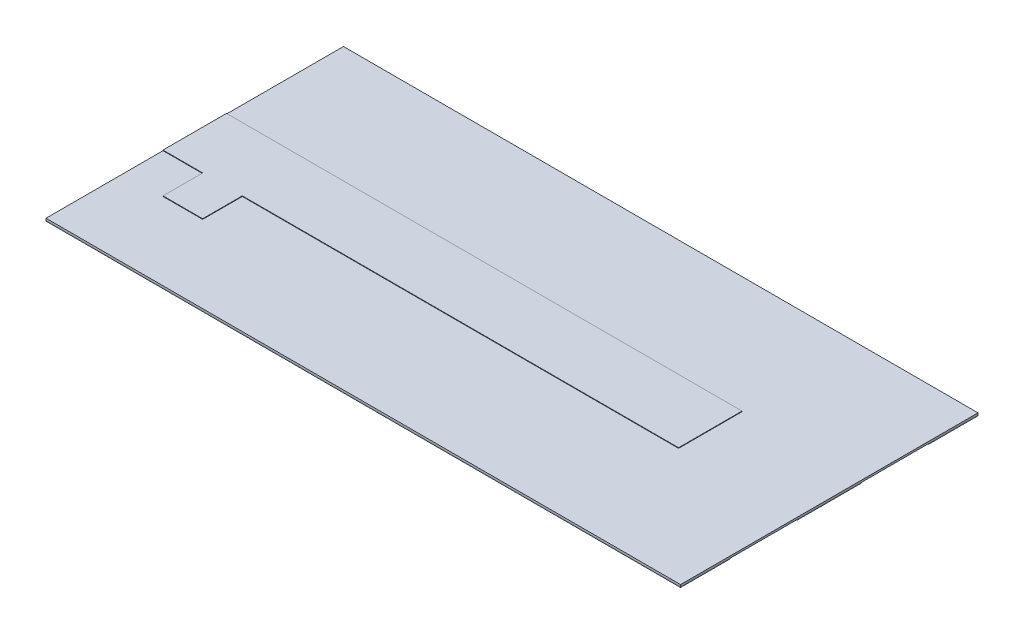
SolidWorks part; units mm, degrees
ref_plane "Front Plane" through (0, 0, 0) normal (0, 0, 1) x (1, 0, 0)
ref_plane "Top Plane" through (0, 0, 0) normal (0, 1, 0) x (1, 0, 0)
ref_plane "Right Plane" through (0, 0, 0) normal (1, 0, 0) x (0, 0, -1)
sketch "Sketch1" plane through (0, 0, 0) normal (0, 1, 0) x (1, 0, 0)
  line L1 (-20.32, 9.525) -> (20.32, 9.525)
  line L2 (-20.32, 9.525) -> (-20.32, -9.525)
  line L3 (-20.32, -9.525) -> (20.32, -9.525)
  line L4 (20.32, 9.525) -> (20.32, -9.525)
  line L5 (-20.32, 9.525) -> (20.32, -9.525) construction
  line L6 (-20.32, -9.525) -> (20.32, 9.525) construction
  point P0 (0, 0)
extrude "Boss-Extrude1" add sketch "Sketch1" along normal blind 0.127
sketch "Sketch3" plane through (0, 0.127, 0) normal (0, 1, 0) x (1, 0, 0)
  line L0 (-20.32, 0) -> (-20.32, 2.032)
  line L1 (-20.32, 9.525) -> (-20.32, -9.525) construction
  line L2 (-20.32, 2.032) -> (12.7, 2.032)
  line L3 (12.7, 2.032) -> (12.7, -2.032)
  line L4 (12.7, -2.032) -> (-20.32, -2.032)
  line L5 (-20.32, -2.032) -> (-20.32, 0)
extrude "Boss-Extrude2" add sketch "Sketch3" along normal blind 0.0356 separate body
sketch "Sketch4" plane through (0, 0, 0) normal (0, -1, 0) x (1, 0, 0)
  line L1 (20.32, -2.032) -> (-2.921, -2.032)
  line L12 (20.32, 9.525) -> (20.32, -9.525) construction
  line L13 (-2.921, -2.032) -> (-2.921, 2.032)
  line L14 (-20.32, 2.032) -> (12.7, 2.032) construction
  line L15 (-2.921, 2.032) -> (20.32, 2.032)
  line L16 (20.32, 2.032) -> (20.32, -2.032)
extrude "Boss-Extrude3" add sketch "Sketch4" along normal blind 0.0356 separate body
sketch "Sketch8" plane through (0, 0, 0) normal (0, -1, 0) x (1, 0, 0)
  line L0 (20.32, 9.525) -> (-20.32, 9.525)
  line L1 (-20.32, 9.525) -> (-20.32, 6.35)
  line L2 (-20.32, -9.525) -> (-20.32, 9.525) construction
  line L3 (-20.32, 6.35) -> (20.32, 6.35)
  line L4 (20.32, 9.525) -> (20.32, -9.525) construction
  line L5 (20.32, 6.35) -> (20.32, 9.525)
  line L6 (-20.32, -9.525) -> (-20.32, -6.35)
  line L7 (-20.32, -6.35) -> (20.32, -6.35)
  line L8 (20.32, -6.35) -> (20.32, -9.525)
  line L9 (20.32, -9.525) -> (-20.32, -9.525)
extrude "Boss-Extrude5" add sketch "Sketch8" along normal blind 0.0356 separate body
sketch "Sketch9" plane through (0, 0.127, 0) normal (0, 1, 0) x (1, 0, 0)
  line L0 (-20.32, -2.032) -> (-17.78, -2.032) construction
  line L1 (-17.78, -2.032) -> (-17.78, -4.572)
  line L2 (-17.78, -4.572) -> (-15.24, -4.572)
  line L3 (-15.24, -4.572) -> (-15.24, -2.032)
  line L4 (-20.32, -2.032) -> (12.7, -2.032) construction
  line L5 (-15.24, -2.032) -> (-17.78, -2.032)
extrude "Boss-Extrude6" add sketch "Sketch9" along normal blind 0.0356
